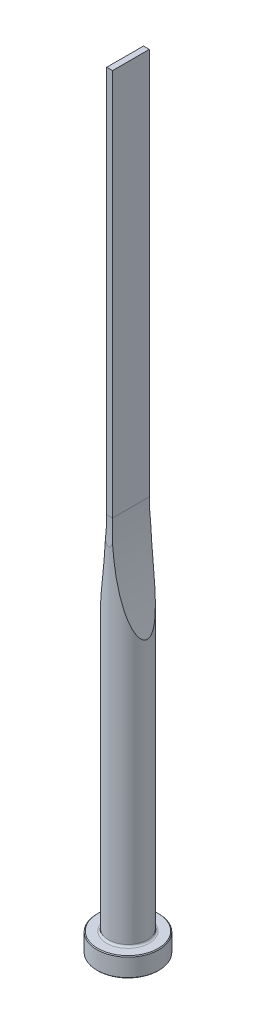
SolidWorks part; units mm, degrees
ref_plane "Front Plane" through (0, 0, 0) normal (0, 0, 1) x (1, 0, 0)
ref_plane "Top Plane" through (0, 0, 0) normal (0, 1, 0) x (1, 0, 0)
ref_plane "Right Plane" through (0, 0, 0) normal (1, 0, 0) x (0, 0, -1)
sketch "Sketch1" plane through (0, 0, 0) normal (0, 0, 1) x (1, 0, 0)
  line L0 (0, 0) -> (7.8, 0)
  line L1 (55, 0) -> (-55, 0) construction
  line L2 (8, 0.2) -> (8, 4.8)
  line L3 (7.8, 5) -> (5.5, 5)
  line L4 (5, 5.5) -> (5, 200)
  line L5 (0, 200) -> (5, 200)
  line L6 (8, 4.8) -> (7.8, 5)
  line L7 (7.8, 0) -> (8, 0.2)
  line L8 (0, 200) -> (0, 0)
  arc A0 (5, 5.5) -> (5.5, 5) centre (5.5, 5.5) ccw
  point P1 (8, 0)
  point P6 (8, 5)
  dimension "D4" = 0.5
  dimension "D1" = 5
  dimension "D2" = 8
  dimension "D3" = 5
  dimension "D5" = 200
revolve "Revolve1" add sketch "Sketch1" angle 360 about L8
sketch "Sketch2" plane through (0, 0, 0) normal (0, 0, 1) x (1, 0, 0)
  line L0 (0.75, 200) -> (0.75, 100)
  line L1 (5, 200) -> (-5, 200) construction
  line L2 (-0.75, 200) -> (-0.75, 100)
  line L3 (5, 200) -> (5, 72.6698)
  line L4 (-5, 200) -> (-5, 72.6698)
  line L5 (0, -8.8) -> (0, 8.8) construction
  line L6 (5, 200) -> (0.75, 200)
  line L8 (-0.75, 200) -> (-5, 200)
  arc A0 (0.75, 100) -> (5, 72.6698) centre (90.75, 100) ccw
  arc A1 (-0.75, 100) -> (-5, 72.6698) centre (-90.75, 100) cw
  dimension "D4" = 90
  dimension "D1" = 100
  dimension "D2" = 1.5
  dimension "D3" = 0.75
extrude "Cut-Extrude1" cut sketch "Sketch2" against normal mid plane 10
sketch "Sketch3" plane through (0, 0, 0) normal (1, 0, 0) x (0, 0, -1)
  line L0 (4.75, 200) -> (4.75, 100)
  line L1 (-4.9434, 200) -> (4.9434, 200) construction
  line L2 (-4.75, 200) -> (-4.75, 100)
  line L3 (5, 200) -> (5, 93.2965)
  line L4 (4.75, 200) -> (5, 200)
  line L5 (0, 8.8) -> (0, -8.8) construction
  line L6 (-5, 200) -> (-5, 93.2965)
  line L8 (-4.75, 200) -> (-5, 200)
  arc A0 (4.75, 100) -> (5, 93.2965) centre (94.75, 100) ccw
  arc A1 (-4.75, 100) -> (-5, 93.2965) centre (-94.75, 100) cw
  dimension "D2" = 90
  dimension "D1" = 100
  dimension "D3" = 9.5
  dimension "D4" = 4.75
extrude "Cut-Extrude2" cut sketch "Sketch3" against normal mid plane 10
